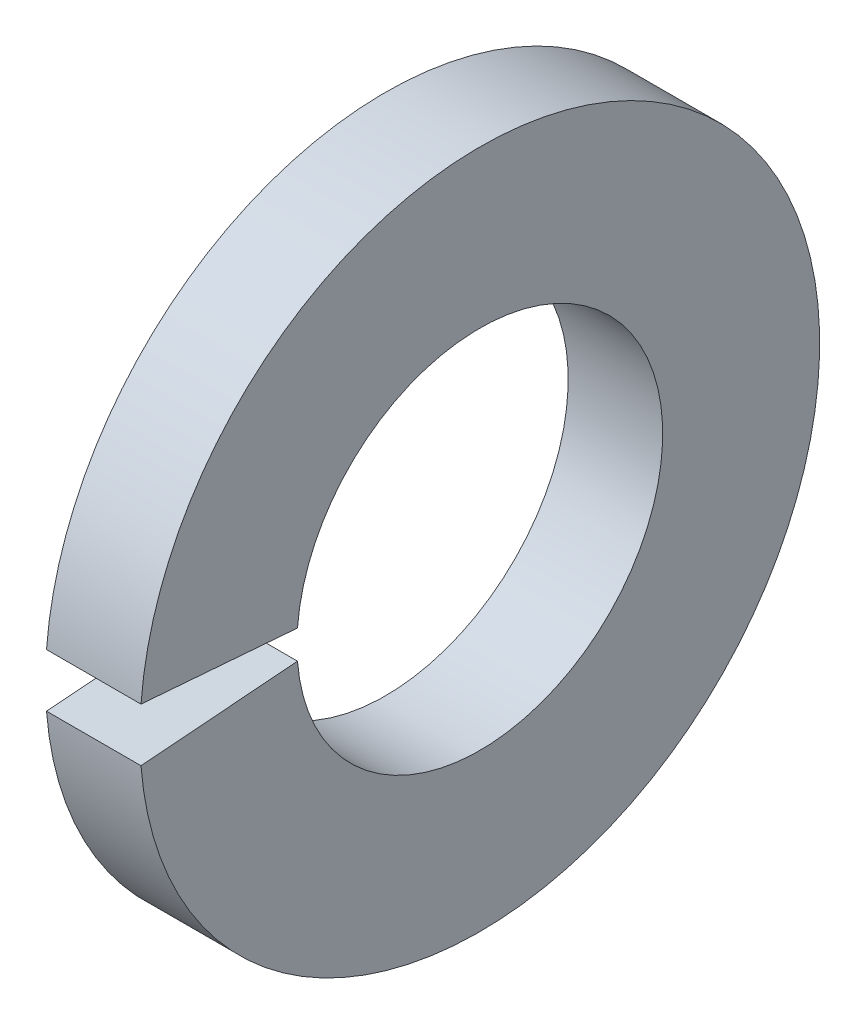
SolidWorks part; units mm, degrees
ref_plane "Plane1" through (0, 0, 0) normal (0, 0, 1) x (1, 0, 0)
ref_plane "Plane2" through (0, 0, 0) normal (0, 1, 0) x (1, 0, 0)
ref_plane "Plane3" through (0, 0, 0) normal (1, 0, 0) x (0, 0, -1)
sketch "Sketch1" plane through (0, 0, 0) normal (0, 0, 1) x (1, 0, 0)
  line L0 (-34.925, 0) -> (9.525, 0) construction
  line L1 (0, 1.524) -> (0, 2.8321)
  line L2 (0, 2.8321) -> (-0.7874, 2.8321)
  line L3 (-0.7874, 2.8321) -> (-0.7874, 1.524)
  line L4 (-0.7874, 1.524) -> (0, 1.524)
  dimension "Thickness" = 0.7874
  dimension "Inside_dia" = 3.048
  dimension "Outside_dia" = 5.6642
revolve "Base-Revolve" add sketch "Sketch1" angle 360 about L0
sketch "Sketch2" plane through (0, 0, 0) normal (-1, 0, 0) x (0, -1, 0)
  line L0 (0, 0) -> (0.2266, 2.8798)
  line L1 (0, -3.175) -> (0, 12.7) construction
  line L2 (0, 0) -> (-0.2266, 2.8798)
  arc A0 (0.2266, 2.8798) -> (-0.2266, 2.8798) centre (0, 0) ccw
  dimension "D1" = 2.8887
  dimension "Gap_ang" = 9
extrude "Gap" cut sketch "Sketch2" along normal through all
equation "\"D1@Sketch2\" = \"Outside_dia@Sketch1\" * 0.51"
